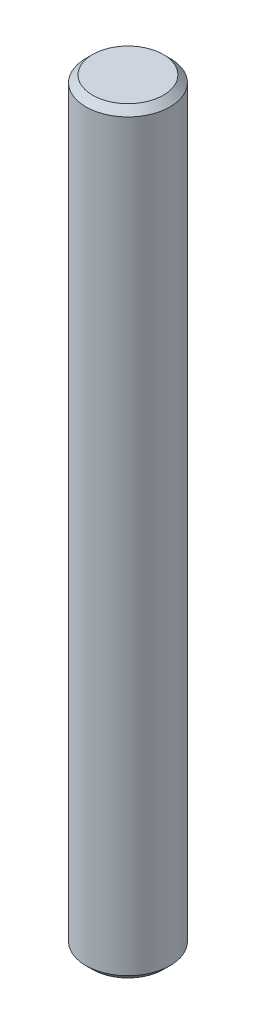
SolidWorks part; units mm, degrees
ref_plane "Front/Back" through (0, 0, 0) normal (0, 0, 1) x (1, 0, 0)
ref_plane "Top/Bottom" through (0, 0, 0) normal (0, 1, 0) x (1, 0, 0)
ref_plane "Right/Left" through (0, 0, 0) normal (1, 0, 0) x (0, 0, -1)
sketch "Sketch1" plane through (0, 0, 0) normal (0, 1, 0) x (1, 0, 0)
  circle A0 centre (0, 0) radius 1.5875
  dimension "D1" = 3.175
extrude "Extrude1" add sketch "Sketch1" along normal mid plane 28.575
chamfer "Chamfer1" distance 0.254 angle 45
